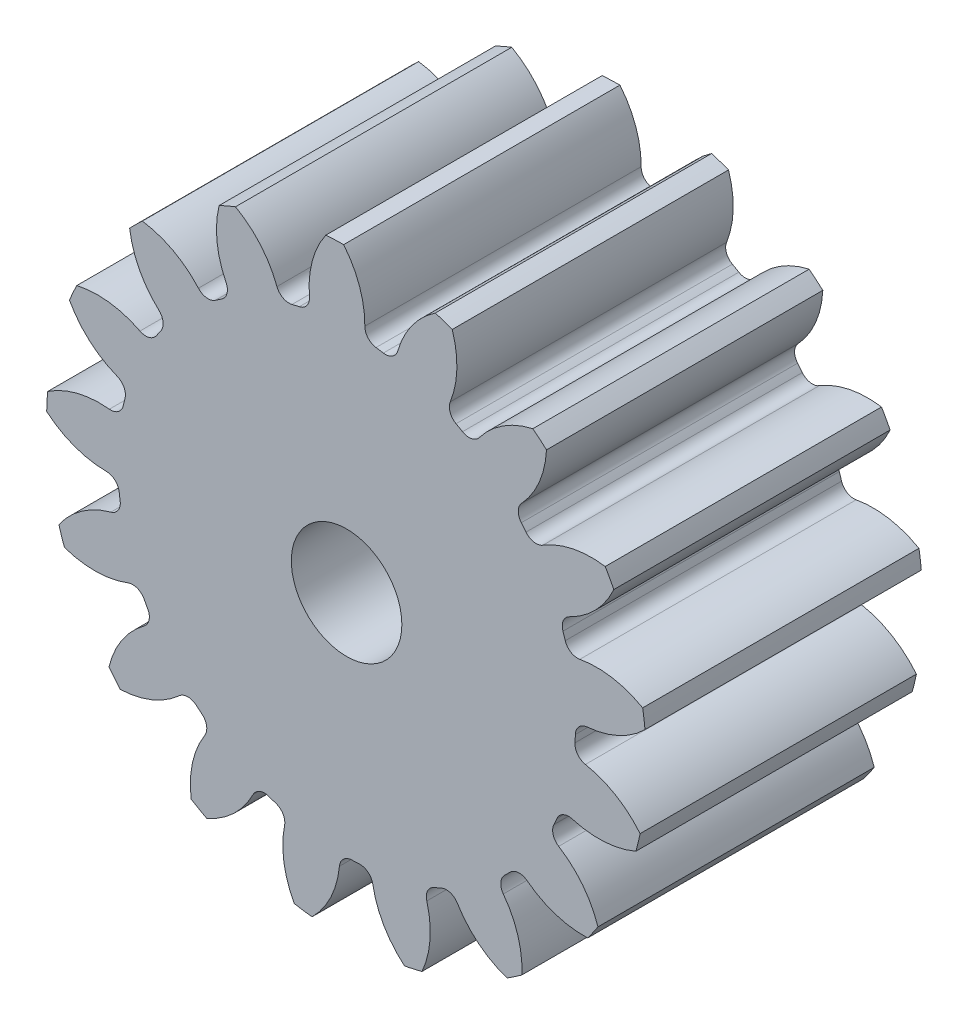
SolidWorks part; units mm, degrees
ref_plane "Front" through (0, 0, 0) normal (0, 0, 1) x (1, 0, 0)
ref_plane "Top" through (0, 0, 0) normal (0, 1, 0) x (1, 0, 0)
ref_plane "Right" through (0, 0, 0) normal (1, 0, 0) x (0, 0, -1)
sketch "Sketch3" plane through (0, 0, 0) normal (0, 0, 1) x (1, 0, 0)
  circle A0 centre (0, 0) radius 96.52
  dimension "od" = 193.04
extrude "gearBody" add sketch "Sketch3" along normal blind 88.9
sketch "Sketch2" plane through (0, 0, 0) normal (0, 0, 1) x (1, 0, 0)
  line L0 (0, 0) -> (74.9745, 31.0555) construction
  line L1 (94.8887, -20.4812) -> (0, 0) construction
  line L2 (0, 0) -> (36.3143, 0) construction
  line L3 (86.2929, 3.404) -> (85.4521, -12.4897) construction
  line L5 (85.8725, -4.5429) -> (0, 0) construction
  line L7 (0, 0) -> (81.1519, 0) construction
  arc A0 (81.1315, 1.8185) -> (80.4868, -10.3685) centre (0, 0) ccw construction
  arc A1 (96.0167, 9.8438) -> (94.4422, -19.9195) centre (0, 0) ccw construction
  arc A2 (86.2929, 3.404) -> (85.4521, -12.4897) centre (0, 0) ccw construction
  arc A3 (73.4841, -5.0879) -> (73.6107, -2.6938) centre (0, 0) ccw
  arc A4 (94.8887, -20.4812) -> (76.8398, -9.4364) centre (71.2794, -38.7927) ccw
  arc A5 (94.8887, -20.4812) -> (96.52, 10.3552) centre (0, 0) ccw
  arc A6 (96.52, 10.3552) -> (77.4065, 1.2764) centre (74.9745, 31.0555) cw
  arc A7 (73.6107, -2.6938) -> (77.4065, 1.2764) centre (77.7431, -2.845) cw
  arc A8 (76.8398, -9.4364) -> (73.4841, -5.0879) centre (77.6093, -5.3735) cw
  point P6 (96.52, 10.3552)
  point P22 (94.8887, -20.4812)
  dimension "baseDia" = 162.3037
  dimension "od" = 193.04
  dimension "pd" = 172.72
  dimension "rd" = 147.32
  dimension "rFillet" = 4.1351
  dimension "pointX" = 96.52
  dimension "pointY" = 10.3552
  dimension "CTT" = 15.8937
  dimension "flankCenterAngle" = 22.5
extrude "toothCut" cut sketch "Sketch2" along normal through all
pattern_circular "CirPattern1" count 17 over 360 about axis through (0, 0, 0) along (0, 0, 1) of "toothCut"
sketch "hub1Dia" plane through (0, 0, 0) normal (0, 0, -1) x (-1, 0, 0)
  circle A0 centre (0, 0) radius 12.7
  dimension "hub1Dia" = 25.4
sketch "hub2Dia" plane through (0, 0, 88.9) normal (0, 0, 1) x (1, 0, 0)
  circle A0 centre (0, 0) radius 12.7
  dimension "hub2dia" = 25.4
sketch "boreDia" plane through (0, 0, 0) normal (0, 0, 1) x (1, 0, 0)
  circle A0 centre (0, 0) radius 17.78
  dimension "boreDia" = 35.56
extrude "bore" cut sketch "boreDia" against normal mid plane 25400
